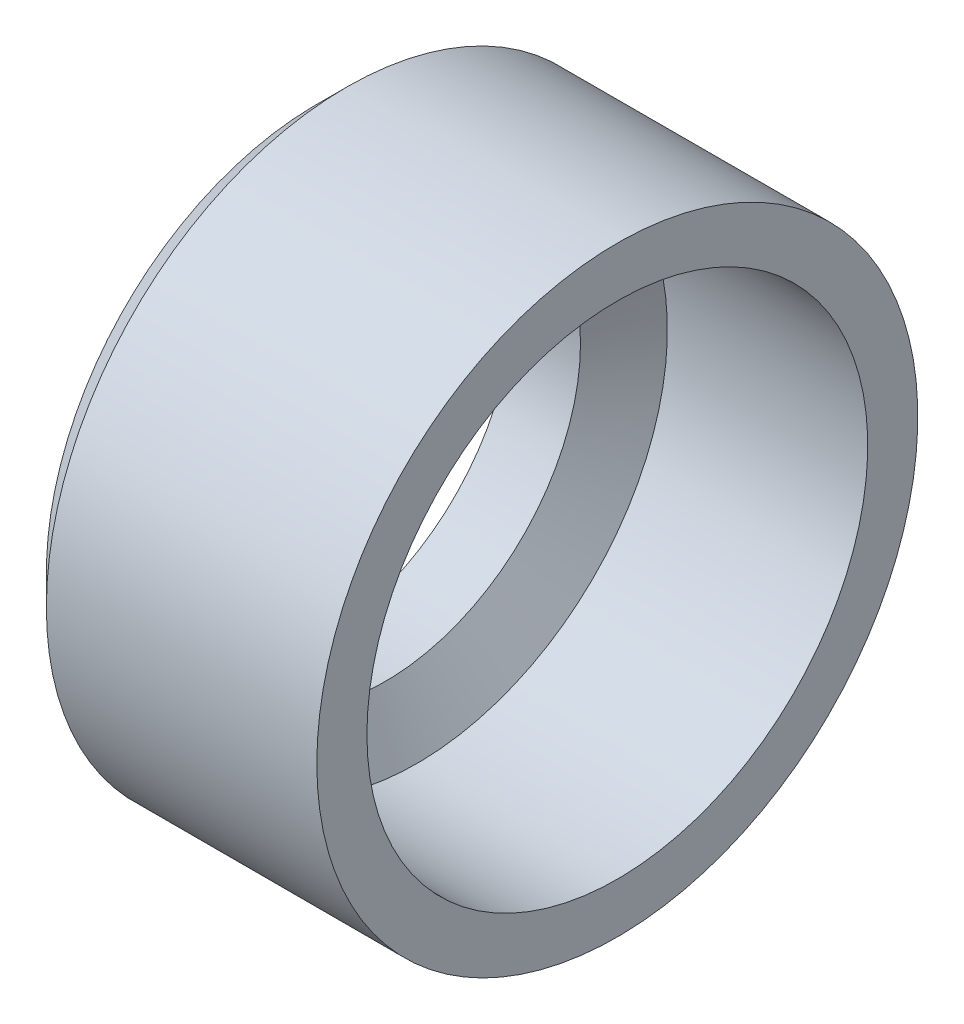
SolidWorks part; units mm, degrees
ref_plane "Vorne" through (0, 0, 0) normal (0, 0, 1) x (1, 0, 0)
ref_plane "Oben" through (0, 0, 0) normal (0, 1, 0) x (1, 0, 0)
ref_plane "Rechts" through (0, 0, 0) normal (1, 0, 0) x (0, 0, -1)
sketch "Skizze1" plane through (0, 0, 0) normal (0, 0, 1) x (1, 0, 0)
  line L0 (0, 0) -> (13.9701, 0) construction
  line L1 (0, 1.95) -> (0.6825, 1.95)
  line L2 (0.6825, 1.95) -> (1, 2.5)
  line L3 (1, 2.5) -> (3, 2.5)
  line L4 (3, 2.5) -> (3, 3)
  line L5 (3, 3) -> (0, 3)
  line L6 (0, 3) -> (0, 1.95)
  dimension "D1" = 3.9
  dimension "D2" = 60
  dimension "D3" = 5
  dimension "D4" = 6
  dimension "D5" = 3
  dimension "D6" = 2
revolve "Rotation1" add sketch "Skizze1" angle 360 about L0
chamfer "Fase1" distance 0.3 angle 45 1 edges at (0, 0, 3)
